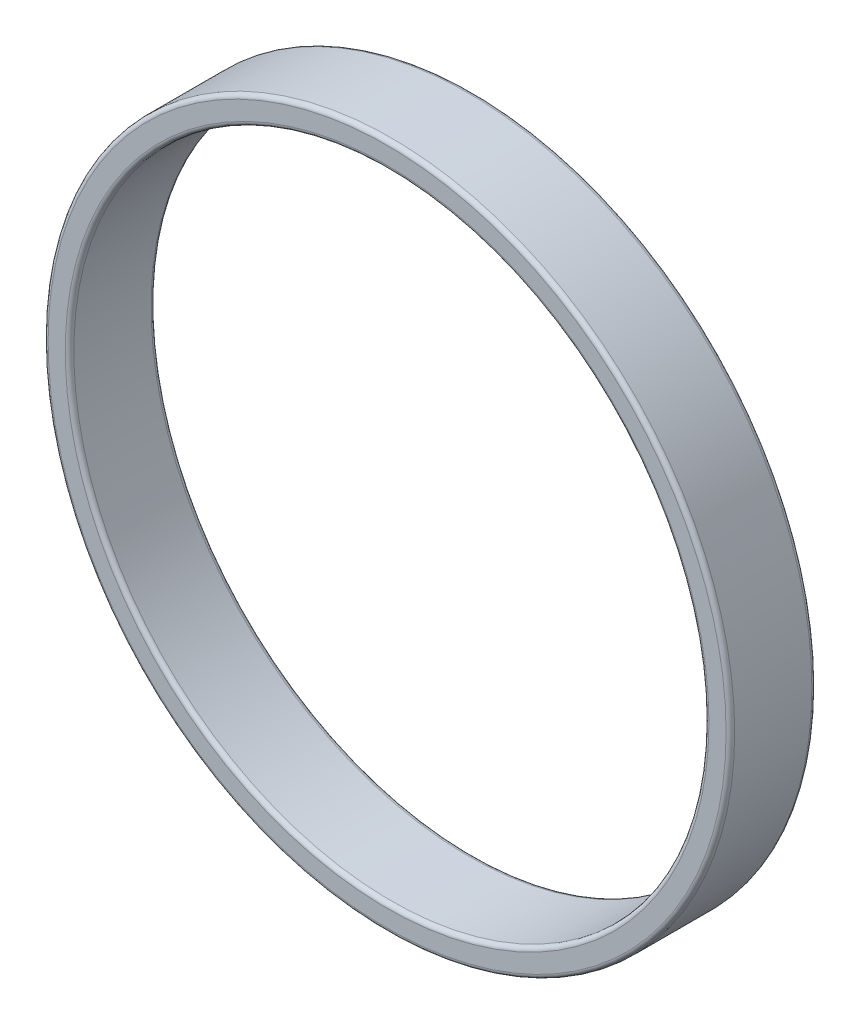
SolidWorks part; units mm, degrees
ref_plane "Front Plane" through (0, 0, 0) normal (0, 0, 1) x (1, 0, 0)
ref_plane "Top Plane" through (0, 0, 0) normal (0, 1, 0) x (1, 0, 0)
ref_plane "Right Plane" through (0, 0, 0) normal (1, 0, 0) x (0, 0, -1)
sketch "Sketch1" plane through (0, 0, 0) normal (0, 0, 1) x (1, 0, 0)
  circle A0 centre (0, 0) radius 50.8
  circle A1 centre (0, 0) radius 46.99
  dimension "D1" = 101.6
  dimension "D2" = 3.81
extrude "Boss-Extrude1" add sketch "Sketch1" along normal blind 12.7
fillet "Fillet1" radius 0.635 4 edges at (46.99, 0, 0) (50.8, 0, 0) (46.99, 0, 12.7) (50.8, 0, 12.7)
